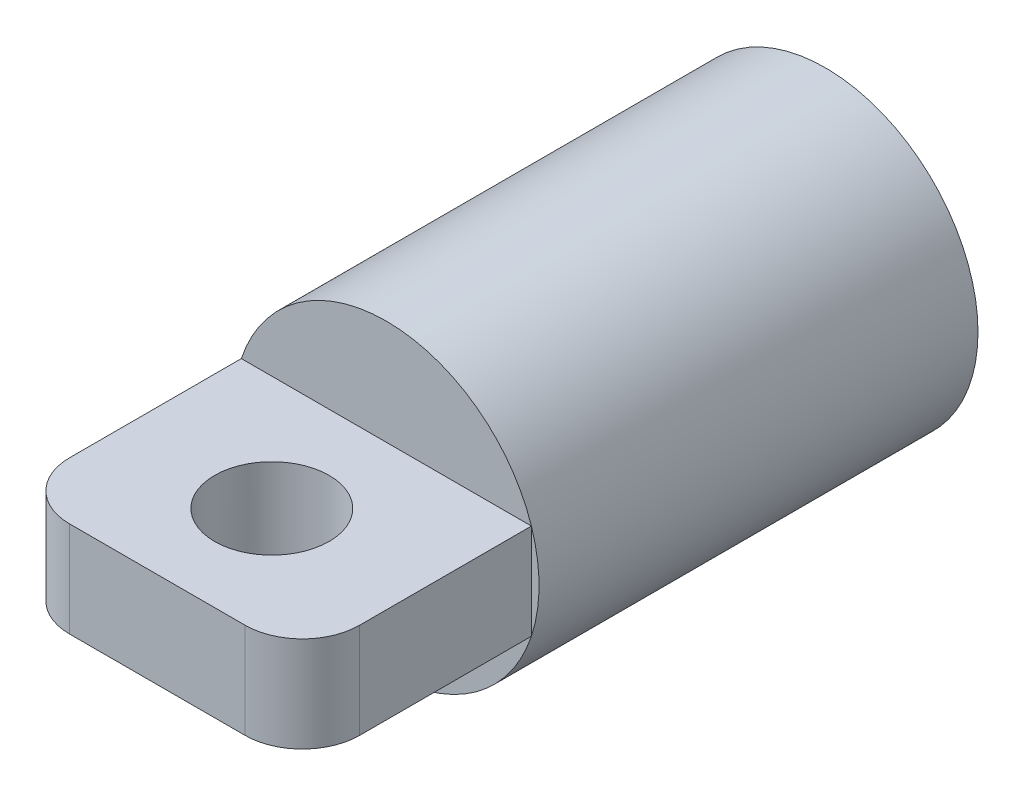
SolidWorks part; units mm, degrees
ref_plane "Front Plane" through (0, 0, 0) normal (0, 0, 1) x (1, 0, 0)
ref_plane "Top Plane" through (0, 0, 0) normal (0, 1, 0) x (1, 0, 0)
ref_plane "Right Plane" through (0, 0, 0) normal (1, 0, 0) x (0, 0, -1)
sketch "Sketch1" plane through (0, 0, 0) normal (0, 0, 1) x (1, 0, 0)
  circle A0 centre (0, 0) radius 8
  dimension "D1" = 16
extrude "Boss-Extrude1" add sketch "Sketch1" along normal blind 35
sketch "Sketch2" plane through (0, 0, 35) normal (0, 0, 1) x (1, 0, 0)
  line L1 (-7.5993, -2.5) -> (7.5993, -2.5)
  line L2 (-7.5993, -2.5) -> (-7.5993, 2.5)
  line L3 (-7.5993, 2.5) -> (7.5993, 2.5)
  line L4 (7.5993, -2.5) -> (7.5993, 2.5)
  line L5 (-7.5993, -2.5) -> (7.5993, 2.5) construction
  line L6 (-7.5993, 2.5) -> (7.5993, -2.5) construction
  circle A4 centre (0, 0) radius 8 construction
  point P0 (0, 0)
  dimension "D1" = 5
extrude "Cut-Extrude1" cut sketch "Sketch2" against normal blind 12 flip side to cut
fillet "Fillet2" radius 3 2 edges at (7.5993, 0, 35) (-7.5993, 0, 35)
sketch "Sketch4" plane through (0, -2.5, 0) normal (0, -1, 0) x (1, 0, 0)
  line L0 (-7.5993, 32) -> (0, 32) construction
  circle A0 centre (0, 29) radius 3
  dimension "D1" = 6
extrude "Cut-Extrude2" cut sketch "Sketch4" against normal blind 8
